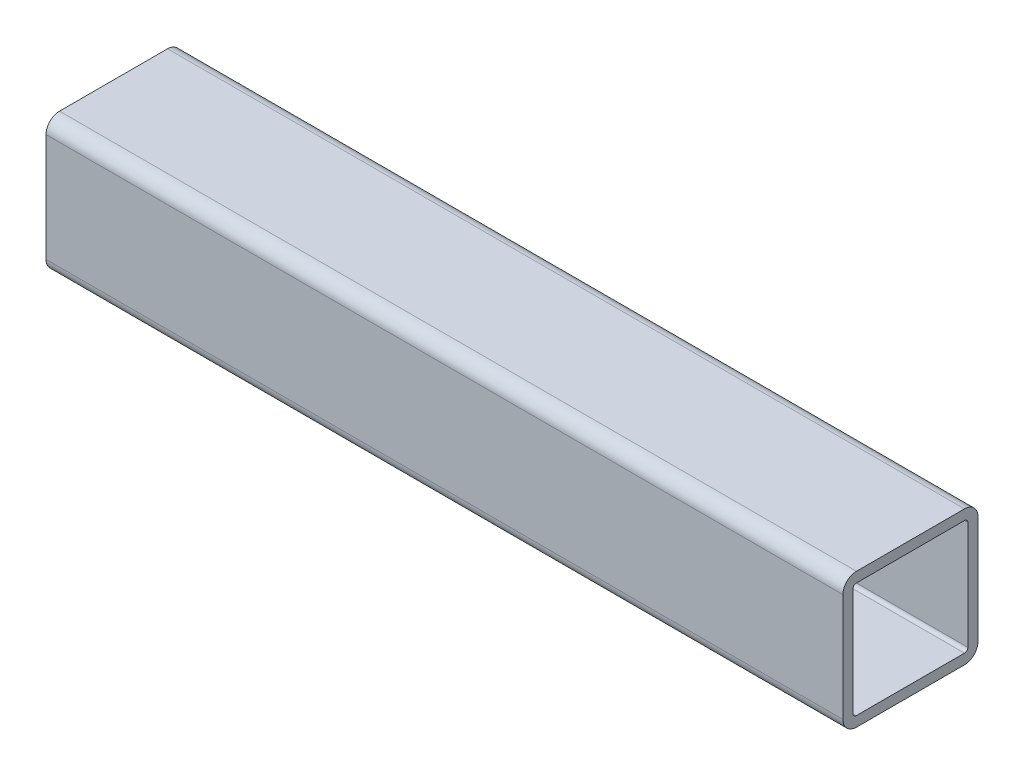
SolidWorks part; units mm, degrees
ref_plane "Plan de face" through (0, 0, 0) normal (0, 0, 1) x (1, 0, 0)
ref_plane "Plan de dessus" through (0, 0, 0) normal (0, 1, 0) x (1, 0, 0)
ref_plane "Plan de droite" through (0, 0, 0) normal (1, 0, 0) x (0, 0, -1)
sketch "Esquisse1" plane through (0, 0, 0) normal (0, 0, 1) x (1, 0, 0)
  line L0 (59, 0) -> (-59, 0)
  dimension "D1" = 118
other "Elément mécano-soudé1"
ref_plane "Plan1" through (59, 0, 0) normal (-1, 0, 0) x (0, 0, 1)
sketch "Sketch11" plane through (59, 0, 0) normal (-1, 0, 0) x (0, 0, 1)
  line L0 (-8, -8.5) -> (8, -8.5)
  line L1 (-8.5, -8) -> (-8.5, 8)
  line L2 (8, 8.5) -> (-8, 8.5)
  line L3 (8.5, 8) -> (8.5, -8)
  line L4 (-8, -10) -> (8, -10)
  line L5 (-10, -8) -> (-10, 8)
  line L6 (8, 10) -> (-8, 10)
  line L7 (10, 8) -> (10, -8)
  arc A0 (10, 8) -> (8, 10) centre (8, 8) ccw
  arc A1 (8, -10) -> (10, -8) centre (8, -8) ccw
  arc A2 (-10, -8) -> (-8, -10) centre (-8, -8) ccw
  arc A3 (-8, 10) -> (-10, 8) centre (-8, 8) ccw
  arc A4 (-8, 8.5) -> (-8.5, 8) centre (-8, 8) ccw
  arc A5 (8.5, 8) -> (8, 8.5) centre (8, 8) ccw
  arc A6 (8, -8.5) -> (8.5, -8) centre (8, -8) ccw
  arc A7 (-8.5, -8) -> (-8, -8.5) centre (-8, -8) ccw
  point P0 (-10, 0)
  point P1 (10, 0)
  point P2 (0, 10)
  point P3 (0, -10)
  point P4 (0, 0)
  point P5 (-10, -10)
  point P6 (10, -10)
  point P7 (10, 10)
  point P8 (-10, 10)
  point P33 (0, 0)
  dimension "D1" = 2
  dimension "Thickness" = 1.5
  dimension "V_leg" = 20
